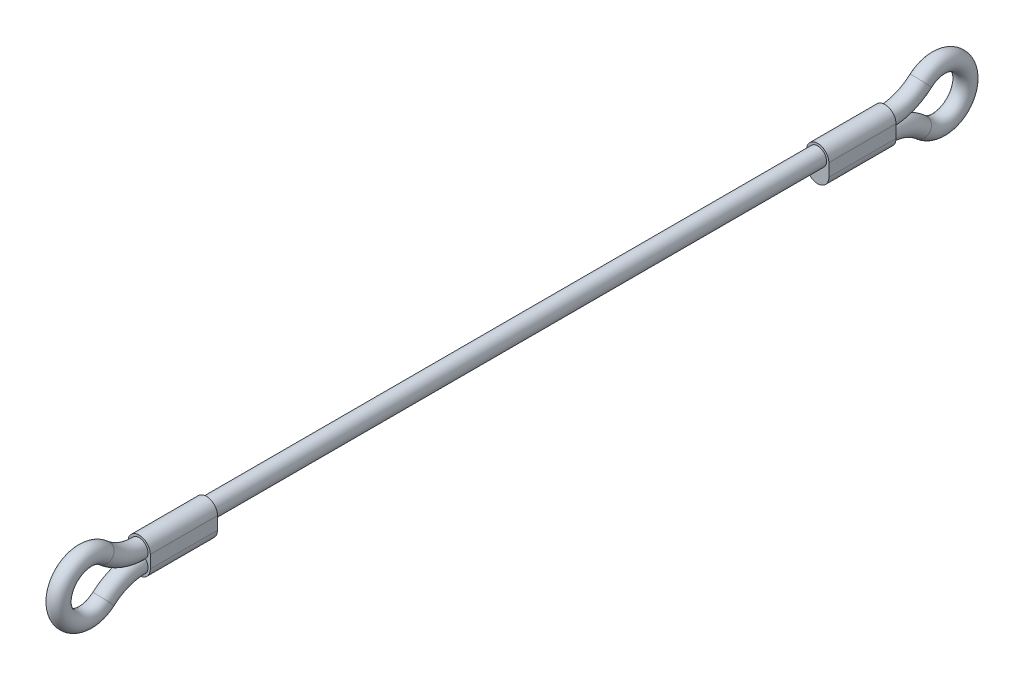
SolidWorks part; units mm, degrees
ref_plane "Front Plane" through (0, 0, 0) normal (0, 0, 1) x (1, 0, 0)
ref_plane "Top Plane" through (0, 0, 0) normal (0, 1, 0) x (1, 0, 0)
ref_plane "Right Plane" through (0, 0, 0) normal (1, 0, 0) x (0, 0, -1)
sketch "Sketch1" plane through (0, 0, 0) normal (1, 0, 0) x (0, 0, -1)
  line L0 (66.6, 0) -> (-66.6, 0)
  line L1 (0, 1.32) -> (0, -1.32) construction
  arc A0 (-66.6, 0) -> (-73, 2.4446) centre (-66.6, 9.6) cw
  arc A1 (-73, 2.4446) -> (-73, -4.7108) centre (-76.2, -1.1331) ccw
  arc A2 (-73, -4.7108) -> (-66.6, -2.2663) centre (-66.6, -11.8663) cw
  arc A3 (73, -4.7108) -> (66.6, -2.2663) centre (66.6, -11.8663) ccw
  arc A4 (73, 2.4446) -> (73, -4.7108) centre (76.2, -1.1331) cw
  arc A5 (66.6, 0) -> (73, 2.4446) centre (66.6, 9.6) ccw
  point P18 (0, 0)
  dimension "D1" = 4.8
  dimension "D4" = 9.6
  dimension "D2" = 76.2
  dimension "D3" = 9.6
sketch "Sketch2" plane through (0, 0, 0) normal (0, 0, 1) x (1, 0, 0)
  circle A0 centre (0, 0) radius 1.59
  dimension "D1" = 3.18
sweep "Sweep1" add profiles "Sketch2" path "Sketch1"
sketch "Sketch3" plane through (0, 0, 66.6) normal (0, 0, -1) x (-1, 0, 0)
  line L0 (0, 0) -> (0, -2.2663) construction
  line L1 (1.995, 0) -> (1.995, -2.2663)
  line L2 (-1.995, 0) -> (-1.995, -2.2663)
  line L3 (-1.59, -2.2663) -> (1.59, -2.2663) construction
  arc A0 (1.995, 0) -> (-1.995, 0) centre (0, 0) ccw
  arc A1 (-1.995, -2.2663) -> (1.995, -2.2663) centre (0, -2.2663) ccw
  point P3 (0, -1.1331)
  dimension "D1" = 3.99
extrude "Boss-Extrude1" add sketch "Sketch3" along normal blind 12
mirror "Mirror1" about plane through (0, 0, 0) normal (0, 0, 1) of "Boss-Extrude1"
